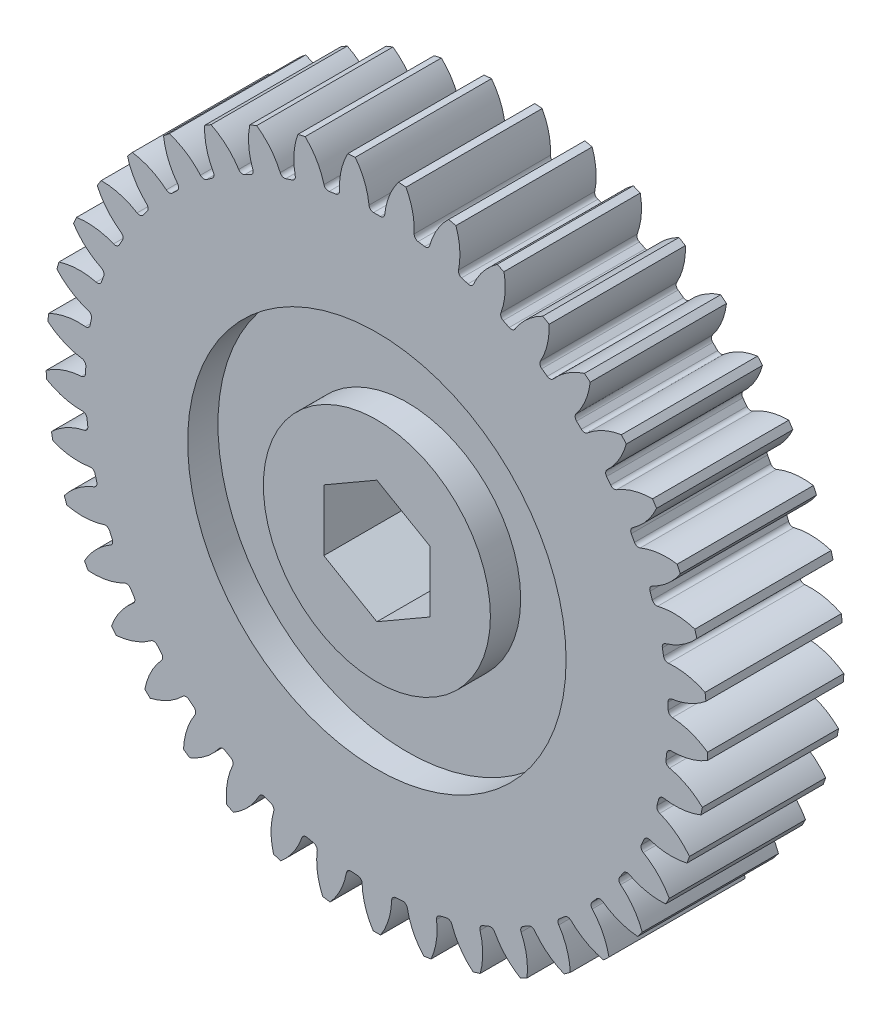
SolidWorks part; units mm, degrees
ref_plane "Ebene vorne" through (0, 0, 0) normal (0, 0, 1) x (1, 0, 0)
ref_plane "Ebene oben" through (0, 0, 0) normal (0, 1, 0) x (1, 0, 0)
ref_plane "Ebene rechts" through (0, 0, 0) normal (1, 0, 0) x (0, 0, -1)
sketch "Skizze1" plane through (0, 0, 0) normal (0, 0, 1) x (1, 0, 0)
  circle A0 centre (0, 0) radius 21.853
  dimension "D1" = 43.706
extrude "Aufsatz-Linear austragen1" add sketch "Skizze1" along normal mid plane 9
sketch "Skizze4" plane through (0, 0, 4.5) normal (0, 0, 1) x (1, 0, 0)
  circle A0 centre (0, 0) radius 7.5
  circle A1 centre (0, 0) radius 12.5
  dimension "D1" = 25
  dimension "D2" = 15
extrude "Schnitt-Linear austragen2" cut sketch "Skizze4" against normal blind 2
sketch "Skizze6" plane through (0, 0, 4.5) normal (0, 0, 1) x (1, 0, 0)
  line L0 (0, 0) -> (0, 21.853) construction
  line L1 (-0.2217, 19.25) -> (0.2217, 19.25)
  circle A0 centre (0, 0) radius 21.853 construction
  arc A1 (0.5201, 19.5188) -> (2.08, 22.5) centre (5.0554, 19.0445) cw
  arc A2 (-0.5201, 19.5188) -> (-2.08, 22.5) centre (-5.0554, 19.0445) ccw
  arc A3 (-2.08, 22.5) -> (2.08, 22.5) centre (0, 4.6206) cw
  arc A4 (0.2217, 19.25) -> (0.5201, 19.5188) centre (0.2217, 19.55) ccw
  arc A5 (-0.5201, 19.5188) -> (-0.2217, 19.25) centre (-0.2217, 19.55) ccw
  point P13 (0, 19.25)
  point P16 (0.5, 19.25)
  point P19 (-0.5, 19.25)
  dimension "D5" = 4.56
  dimension "D6" = 18
  dimension "D7" = 0.3
  dimension "D1" = 0.5
  dimension "D2" = 19.25
  dimension "D3" = 1.58
  dimension "D4" = 3.25
extrude "Schnitt-Linear austragen3" cut sketch "Skizze6" against normal through all
pattern_circular "Kreismuster1" count 41 over 360 about axis through (0, 0, 0) along (0, 0, 1) of "Schnitt-Linear austragen3"
sketch "Skizze8" plane through (0, 0, -4.5) normal (0, 0, -1) x (-1, 0, 0)
  circle A0 centre (0, 0) radius 6
extrude "Aufsatz-Linear austragen2" add sketch "Skizze8" along normal blind 1 contours A0
sketch "Skizze7" plane through (0, 0, 4.5) normal (0, 0, 1) x (1, 0, 0)
  line L1 (0, 4.05) -> (-3.5074, 2.025)
  line L2 (-3.5074, 2.025) -> (-3.5074, -2.025)
  line L3 (-3.5074, -2.025) -> (0, -4.05)
  line L4 (0, -4.05) -> (3.5074, -2.025)
  line L5 (3.5074, -2.025) -> (3.5074, 2.025)
  line L6 (3.5074, 2.025) -> (0, 4.05)
  circle A0 centre (0, 0) radius 3.5074 construction
  dimension "D1" = 8.1
extrude "Schnitt-Linear austragen4" cut sketch "Skizze7" against normal through all
